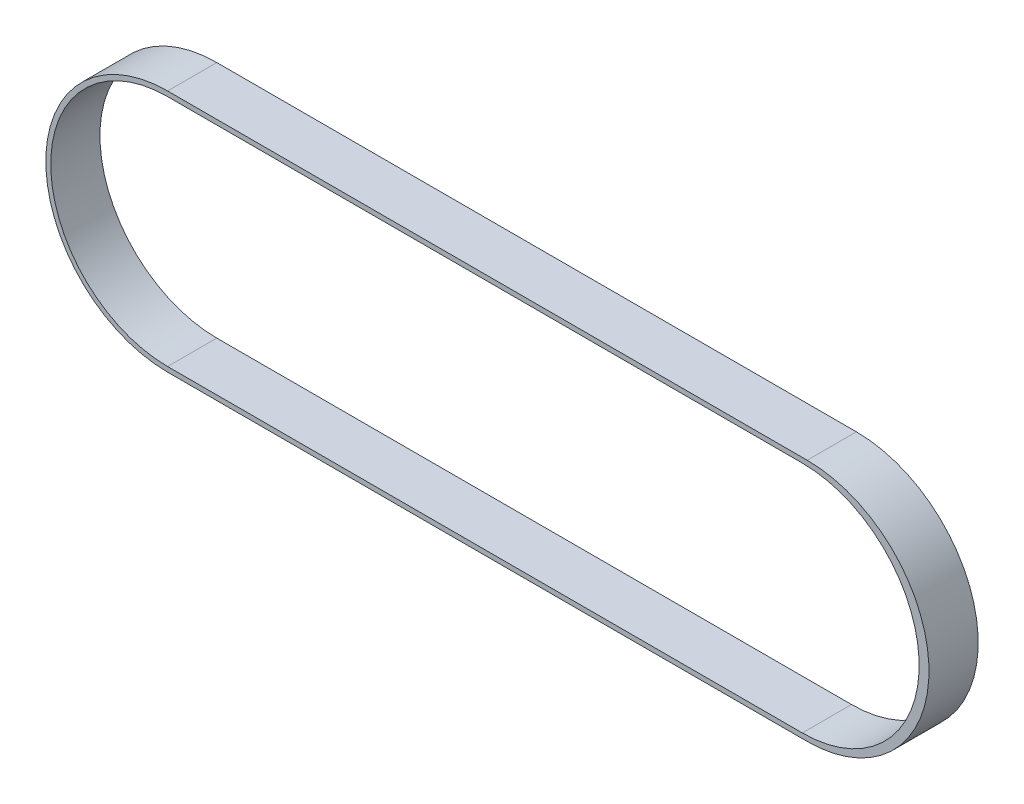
SolidWorks part; units mm, degrees
ref_plane "Front Plane" through (0, 0, 0) normal (0, 0, 1) x (1, 0, 0)
ref_plane "Top Plane" through (0, 0, 0) normal (0, 1, 0) x (1, 0, 0)
ref_plane "Right Plane" through (0, 0, 0) normal (1, 0, 0) x (0, 0, -1)
sketch "Sketch2" plane through (0, 0, 0) normal (0, 0, 1) x (1, 0, 0)
  line L0 (0, 0) -> (165.1, 0) construction
  line L1 (0, 31.4325) -> (165.1, 31.4325)
  line L2 (0, -31.4325) -> (165.1, -31.4325)
  arc A0 (0, 31.4325) -> (0, -31.4325) centre (0, 0) ccw
  arc A1 (165.1, -31.4325) -> (165.1, 31.4325) centre (165.1, 0) ccw
  point P3 (82.55, 0)
  dimension "D1" = 165.1
  dimension "D2" = 62.865
extrude "Boss-Extrude1" add sketch "Sketch2" along normal blind 12.7
sketch "Sketch3" plane through (0, 0, 12.7) normal (0, 0, 1) x (1, 0, 0)
  line L0 (0, 0) -> (163.83, 0) construction
  line L1 (0, 30.1625) -> (163.83, 30.1625)
  line L2 (0, -30.1625) -> (163.83, -30.1625)
  arc A0 (0, 30.1625) -> (0, -30.1625) centre (0, 0) ccw
  arc A1 (163.83, -30.1625) -> (163.83, 30.1625) centre (163.83, 0) ccw
  point P3 (81.915, 0)
  dimension "D1" = 163.83
extrude "Cut-Extrude1" cut sketch "Sketch3" against normal through all
